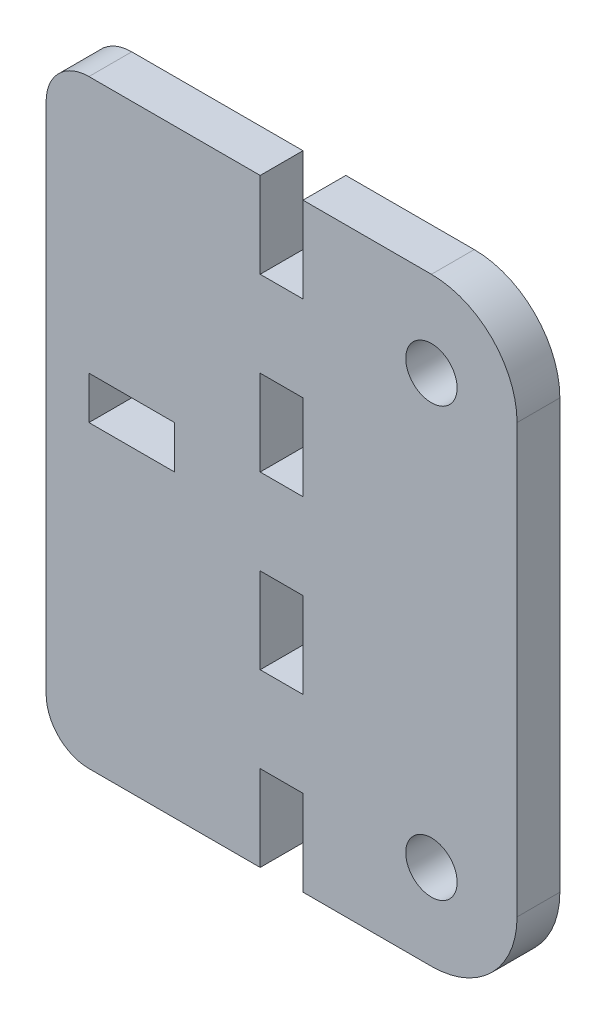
SolidWorks part; units mm, degrees
ref_plane "Plan de face" through (0, 0, 0) normal (0, 0, 1) x (1, 0, 0)
ref_plane "Plan de dessus" through (0, 0, 0) normal (0, 1, 0) x (1, 0, 0)
ref_plane "Plan de droite" through (0, 0, 0) normal (1, 0, 0) x (0, 0, -1)
sketch "Esquisse1" plane through (0, 0, 0) normal (0, 0, 1) x (1, 0, 0)
  line L1 (0, -35) -> (-30, -35)
  line L2 (0, -35) -> (0, 35)
  line L3 (0, 35) -> (-30, 35)
  line L4 (-30, -35) -> (-30, 35)
  dimension "D1" = 30
  dimension "D2" = 70
  dimension "D3" = 35
extrude "Boss.-Extru.1" add sketch "Esquisse1" along normal blind 5
sketch "Esquisse2" plane through (0, 0, 5) normal (0, 0, 1) x (1, 0, 0)
  line L1 (-15, 0) -> (-25, 0)
  line L2 (-15, 0) -> (-15, 5)
  line L3 (-15, 5) -> (-25, 5)
  line L4 (-25, 0) -> (-25, 5)
  dimension "D2" = 10
  dimension "D1" = 15
  dimension "D3" = 5
extrude "Enlèv. mat.-Extru.1" cut sketch "Esquisse2" against normal blind 5
sketch "Esquisse3" plane through (0, 0, 5) normal (0, 0, 1) x (1, 0, 0)
  line L0 (0, -35) -> (0, 35) construction
  line L1 (0, -35) -> (-5, -35)
  line L2 (0, -35) -> (0, -25)
  line L3 (0, -25) -> (-5, -25)
  line L4 (-5, -35) -> (-5, -25)
  line L5 (0, -5) -> (-5, -5)
  line L6 (0, -15) -> (0, -5)
  line L7 (0, -15) -> (-5, -15)
  line L8 (-5, -15) -> (-5, -5)
  line L9 (0, 15) -> (-5, 15)
  line L10 (0, 5) -> (0, 15)
  line L11 (0, 5) -> (-5, 5)
  line L12 (-5, 5) -> (-5, 15)
  line L13 (0, 35) -> (-5, 35)
  line L14 (0, 25) -> (0, 35)
  line L15 (0, 25) -> (-5, 25)
  line L16 (-5, 25) -> (-5, 35)
  dimension "D1" = 5
  dimension "D2" = 10
  dimension "D3" = 25
  dimension "D4" = 4
extrude "Enlèv. mat.-Extru.2" cut sketch "Esquisse3" against normal blind 10
sketch "Esquisse4" plane through (0, 0, 0) normal (1, 0, 0) x (0, 0, -1)
  line L1 (-5, 35) -> (0, 35)
  line L2 (-5, 35) -> (-5, -35)
  line L3 (-5, -35) -> (0, -35)
  line L4 (0, 35) -> (0, -35)
extrude "Boss.-Extru.2" add sketch "Esquisse4" along normal blind 25
sketch "Esquisse5" plane through (0, 0, 5) normal (0, 0, 1) x (1, 0, 0)
  line L0 (0, 35) -> (0, 25) construction
  line L1 (25, 35) -> (0, 35) construction
  line L2 (15, 25) -> (15, -25) construction
  line L3 (25, -35) -> (0, -35) construction
  line L4 (0, -25) -> (0, -35) construction
  circle A0 centre (15, 25) radius 3
  circle A1 centre (15, -25) radius 3
  dimension "D4" = 6
  dimension "D5" = 6
  dimension "D6" = 15
  dimension "D1" = 15
  dimension "D2" = 10
  dimension "D3" = 10
extrude "Enlèv. mat.-Extru.3" cut sketch "Esquisse5" against normal blind 5
fillet "Congé1" radius 10 2 edges at (25, 35, 2.5) (25, -35, 2.5)
fillet "Congé2" radius 5 2 edges at (-30, 35, 2.5) (-30, -35, 2.5)
